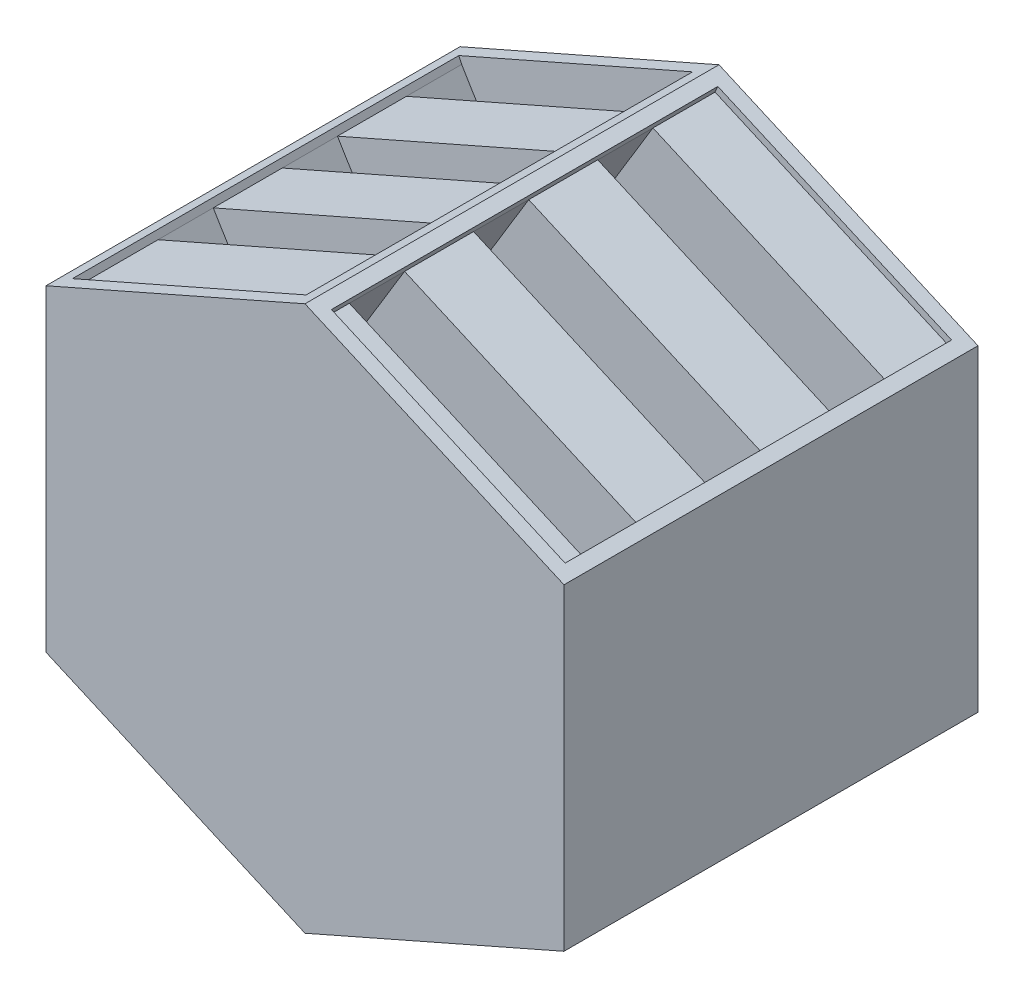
SolidWorks part; units mm, degrees
ref_plane "Plan de face" through (0, 0, 0) normal (0, 0, 1) x (1, 0, 0)
ref_plane "Plan de dessus" through (0, 0, 0) normal (0, 1, 0) x (1, 0, 0)
ref_plane "Plan de droite" through (0, 0, 0) normal (1, 0, 0) x (0, 0, -1)
sketch "Esquisse1" plane through (0, 0, 0) normal (0, 0, 1) x (1, 0, 0)
  line L0 (-187.6666, -263.9447) -> (-187.6666, -33.9447)
  line L1 (-187.6666, -33.9447) -> (0, 48.5553)
  line L2 (0, 48.5553) -> (187.6666, -33.9447)
  line L3 (187.6666, -33.9447) -> (187.6666, -263.9447)
  line L4 (187.6666, -263.9447) -> (0, -346.4447)
  line L5 (0, -346.4447) -> (-187.6666, -263.9447)
  line L6 (-187.6666, -263.9447) -> (187.6666, -33.9447) construction
  line L8 (-187.6666, -33.9447) -> (-184.1625, -35.3218) construction
  line L9 (187.6666, -263.9447) -> (-184.1625, -35.3218) construction
  dimension "D1" = 230
  dimension "D2" = 205
  dimension "D3" = 395
extrude "Extrusion1" add sketch "Esquisse1" along normal mid plane 300
sketch "Esquisse2" plane through (17.8883, 40.6914, 0) normal (0.4024, 0.9154, 0) x (-0.9154, 0.4024, 0)
  line L0 (-185.4595, 150) -> (19.5405, 150) construction
  line L1 (9.5405, 140) -> (-175.4595, 140)
  line L2 (9.5405, 140) -> (9.5405, -140)
  line L3 (9.5405, -140) -> (-175.4595, -140)
  line L4 (-175.4595, 140) -> (-175.4595, -140)
  line L5 (-185.4595, -150) -> (19.5405, -150) construction
  line L6 (19.5405, 150) -> (19.5405, -150) construction
  line L7 (-185.4595, 150) -> (-185.4595, -150) construction
  dimension "D1" = 10
  dimension "D2" = 10
  dimension "D3" = 10
  dimension "D4" = 10
extrude "Enlèv. mat.-Extru.1" cut sketch "Esquisse2" against normal blind 5
sketch "Esquisse3" plane through (-17.8883, 40.6914, 0) normal (-0.4024, 0.9154, 0) x (-0.9154, -0.4024, 0)
  line L0 (-19.5405, -150) -> (185.4595, -150) construction
  line L1 (175.4595, -140) -> (-9.5405, -140)
  line L2 (175.4595, -140) -> (175.4595, 140)
  line L3 (175.4595, 140) -> (-9.5405, 140)
  line L4 (-9.5405, -140) -> (-9.5405, 140)
  line L5 (185.4595, 150) -> (185.4595, -150) construction
  line L6 (-19.5405, 150) -> (-19.5405, -150) construction
  line L7 (-19.5405, 150) -> (185.4595, 150) construction
  dimension "D1" = 10
  dimension "D2" = 10
  dimension "D3" = 10
  dimension "D4" = 10
extrude "Enlèv. mat.-Extru.2" cut sketch "Esquisse3" against normal blind 5
sketch "Esquisse4" plane through (-127.6342, -290.3355, 0) normal (-0.4024, -0.9154, 0) x (0.9154, -0.4024, 0)
  line L0 (-65.5771, 150) -> (139.4229, 150) construction
  line L1 (-55.5771, 140) -> (129.4229, 140)
  line L2 (-55.5771, 140) -> (-55.5771, -140)
  line L3 (-55.5771, -140) -> (129.4229, -140)
  line L4 (129.4229, 140) -> (129.4229, -140)
  line L5 (-65.5771, 150) -> (-65.5771, -150) construction
  line L6 (139.4229, 150) -> (139.4229, -150) construction
  line L7 (-65.5771, -150) -> (139.4229, -150) construction
  dimension "D1" = 10
  dimension "D2" = 10
  dimension "D3" = 10
  dimension "D4" = 10
extrude "Enlèv. mat.-Extru.3" cut sketch "Esquisse4" against normal blind 8
sketch "Esquisse5" plane through (127.6342, -290.3355, 0) normal (0.4024, -0.9154, 0) x (0.9154, 0.4024, 0)
  line L0 (-139.4229, 150) -> (-139.4229, -150) construction
  line L1 (-129.4229, 140) -> (55.5771, 140)
  line L2 (-129.4229, 140) -> (-129.4229, -140)
  line L3 (-129.4229, -140) -> (55.5771, -140)
  line L4 (55.5771, 140) -> (55.5771, -140)
  line L5 (65.5771, 150) -> (65.5771, -150) construction
  line L6 (-139.4229, 150) -> (65.5771, 150) construction
  line L7 (-139.4229, -150) -> (65.5771, -150) construction
  dimension "D1" = 10
  dimension "D2" = 10
  dimension "D3" = 10
  dimension "D4" = 10
extrude "Enlèv. mat.-Extru.4" cut sketch "Esquisse5" against normal blind 8
sketch "Esquisse6" plane through (0, 0, -140) normal (0, 0, 1) x (1, 0, 0)
  line L2 (-7.1423, 39.9536) -> (-176.4999, -34.4976) construction
  line L3 (-7.1423, 39.9536) -> (175.2926, -260.6456)
  line L4 (5.935, -335.0968) -> (175.2926, -260.6456) construction
  line L5 (175.2926, -260.6456) -> (178.5121, -267.9691) construction
  line L6 (175.2926, -260.6456) -> (5.935, -335.0968)
  line L7 (5.935, -335.0968) -> (9.1545, -342.4203) construction
  line L8 (5.935, -335.0968) -> (-176.4999, -34.4976)
  line L9 (-176.4999, -34.4976) -> (-178.5121, -29.9203) construction
  line L10 (-176.4999, -34.4976) -> (-7.1423, 39.9536)
extrude "Enlèv. mat.-Extru.5" cut sketch "Esquisse6" along normal blind 40
ref_plane "Plan1" through (0, 0, -95) normal (0, 0, 1) x (1, 0, 0)
sketch "Esquisse7" plane through (0, 0, -95) normal (0, 0, 1) x (1, 0, 0)
  line L0 (176.4999, -34.4976) -> (-5.935, -335.0968)
  line L3 (7.1423, 39.9536) -> (-175.2926, -260.6456)
  line L4 (176.4999, -34.4976) -> (7.1423, 39.9536) construction
  line L5 (7.1423, 39.9536) -> (9.1545, 44.5309) construction
  line L9 (-175.2926, -260.6456) -> (-178.5121, -267.9691) construction
  line L10 (-175.2926, -260.6456) -> (-5.935, -335.0968) construction
  line L11 (-5.935, -335.0968) -> (-9.1545, -342.4203) construction
  line L12 (176.4999, -34.4976) -> (178.5121, -29.9203) construction
  line L13 (7.1423, 39.9536) -> (176.4999, -34.4976)
  line L14 (-175.2926, -260.6456) -> (-5.935, -335.0968)
extrude "Enlèv. mat.-Extru.6" cut sketch "Esquisse7" along normal blind 40
pattern_linear "Répétition linéaire1" count 3 spacing 90 along (0, 0, 1) of "Enlèv. mat.-Extru.5", "Enlèv. mat.-Extru.6"
